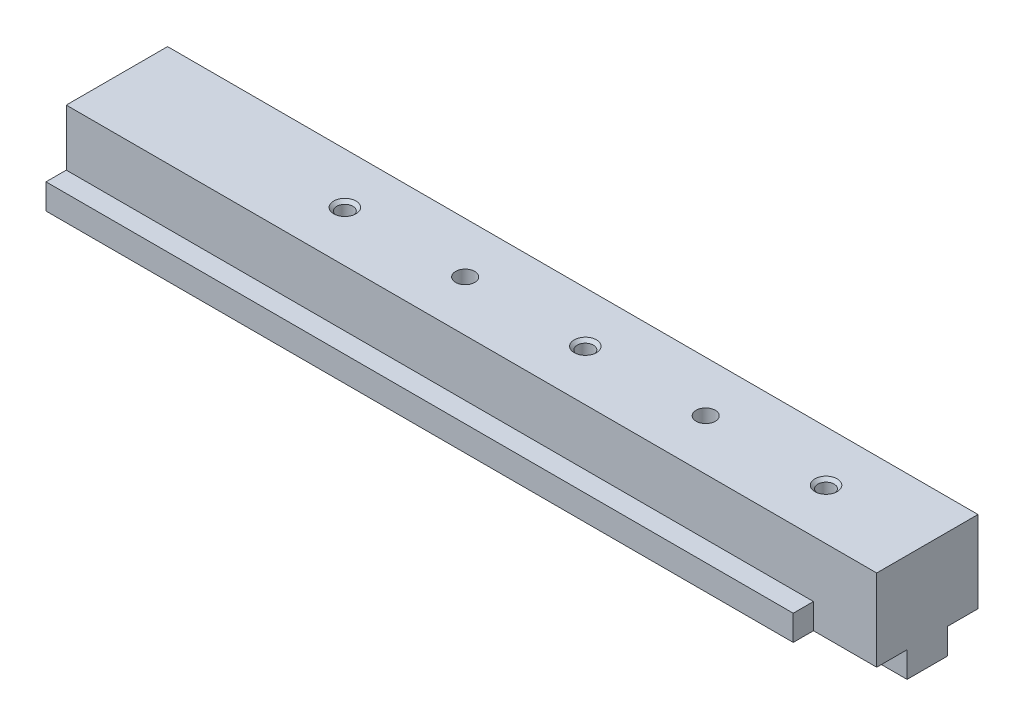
SolidWorks part; units mm, degrees
ref_plane "Front Plane" through (0, 0, 0) normal (0, 0, 1) x (1, 0, 0)
ref_plane "Top Plane" through (0, 0, 0) normal (0, 1, 0) x (1, 0, 0)
ref_plane "Right Plane" through (0, 0, 0) normal (1, 0, 0) x (0, 0, -1)
sketch "Sketch1" plane through (0, 0, 0) normal (1, 0, 0) x (0, 0, -1)
  line L0 (-8.89, 3.2258) -> (-2.54, 3.2258)
  line L1 (-2.54, 3.2258) -> (-2.54, 0)
  line L2 (-2.54, 0) -> (2.54, 0)
  line L3 (2.54, 0) -> (2.54, 3.2258)
  line L4 (2.54, 3.2258) -> (8.89, 3.2258)
  line L5 (8.89, 3.2258) -> (8.89, 6.4008)
  line L6 (8.89, 6.4008) -> (6.35, 6.4008)
  line L7 (6.35, 6.4008) -> (6.35, 13.462)
  line L8 (6.35, 13.462) -> (-6.35, 13.462)
  line L9 (-6.35, 13.462) -> (-6.35, 6.4008)
  line L10 (-6.35, 6.4008) -> (-8.89, 6.4008)
  line L11 (-8.89, 6.4008) -> (-8.89, 3.2258)
extrude "Extrude1" add sketch "Sketch1" along normal blind 93.6752
ref_plane "Plane1" through (93.6752, 0, 0) normal (1, 0, 0) x (0, 0, -1)
sketch "Sketch2" plane through (93.6752, 0, 0) normal (1, 0, 0) x (0, 0, -1)
  line L0 (-6.35, 3.2258) -> (-2.54, 3.2258)
  line L1 (-2.54, 3.2258) -> (-2.54, 0)
  line L2 (-2.54, 0) -> (2.54, 0)
  line L3 (2.54, 0) -> (2.54, 3.2258)
  line L4 (2.54, 3.2258) -> (6.35, 3.2258)
  line L5 (6.35, 3.2258) -> (6.35, 13.462)
  line L6 (6.35, 13.462) -> (-6.35, 13.462)
  line L7 (-6.35, 13.462) -> (-6.35, 3.2258)
extrude "Extrude2" add sketch "Sketch2" along normal blind 7.9248
ref_plane "Plane2" through (88.9, 0, 0) normal (1, 0, 0) x (0, 0, -1)
sketch "Sketch3" plane through (88.9, 0, 0) normal (1, 0, 0) x (0, 0, -1)
  line L0 (0, 13.462) -> (1.397, 13.462)
  line L1 (1.397, 13.462) -> (1.016, 13.081)
  line L2 (1.016, 13.081) -> (1.016, 5.7936)
  line L3 (1.016, 5.7936) -> (0, 5.207)
  line L4 (0, 5.207) -> (0, 13.462)
  line L5 (0, 5.207) -> (0, 13.462) construction
revolve "Cut-Revolve1" cut sketch "Sketch3" angle 360 about L5
ref_plane "Plane3" through (88.9, 0, 0) normal (1, 0, 0) x (0, 0, -1)
ref_plane "Plane4" through (58.7248, 0, 0) normal (1, 0, 0) x (0, 0, -1)
sketch "Sketch4" plane through (58.7248, 0, 0) normal (1, 0, 0) x (0, 0, -1)
  line L0 (0, 13.462) -> (1.397, 13.462)
  line L1 (1.397, 13.462) -> (1.016, 13.081)
  line L2 (1.016, 13.081) -> (1.016, 5.7936)
  line L3 (1.016, 5.7936) -> (0, 5.207)
  line L4 (0, 5.207) -> (0, 13.462)
  line L5 (0, 5.207) -> (0, 13.462) construction
revolve "Cut-Revolve2" cut sketch "Sketch4" angle 360 about L5
ref_plane "Plane5" through (28.575, 0, 0) normal (1, 0, 0) x (0, 0, -1)
sketch "Sketch5" plane through (28.575, 0, 0) normal (1, 0, 0) x (0, 0, -1)
  line L0 (0, 13.462) -> (1.397, 13.462)
  line L1 (1.397, 13.462) -> (1.016, 13.081)
  line L2 (1.016, 13.081) -> (1.016, 5.7936)
  line L3 (1.016, 5.7936) -> (0, 5.207)
  line L4 (0, 5.207) -> (0, 13.462)
  line L5 (0, 5.207) -> (0, 13.462) construction
revolve "Cut-Revolve3" cut sketch "Sketch5" angle 360 about L5
ref_plane "Plane6" through (0, 13.462, 0) normal (0, 1, 0) x (-1, 0, 0)
sketch "Sketch6" plane through (0, 13.462, 0) normal (0, 1, 0) x (-1, 0, 0)
  circle A0 centre (-73.8124, 0) radius 1.2027
extrude "Cut-Extrude1" cut sketch "Sketch6" against normal blind 3.048
sketch "Sketch7" plane through (0, 13.462, 0) normal (0, 1, 0) x (-1, 0, 0)
  circle A0 centre (-43.6626, 0) radius 1.2027
extrude "Cut-Extrude2" cut sketch "Sketch7" against normal blind 3.048
